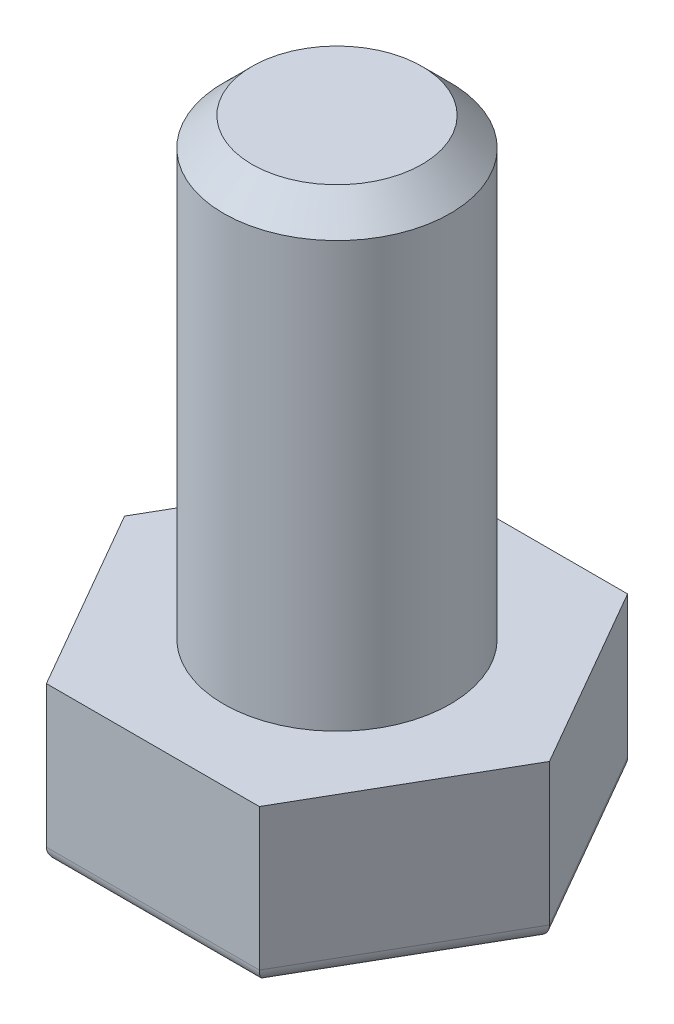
SolidWorks part; units mm, degrees
ref_plane "Plan de face" through (0, 0, 0) normal (0, 0, 1) x (1, 0, 0)
ref_plane "Plan de dessus" through (0, 0, 0) normal (0, 1, 0) x (1, 0, 0)
ref_plane "Plan de droite" through (0, 0, 0) normal (1, 0, 0) x (0, 0, -1)
sketch "Esquisse1" plane through (0, 0, 0) normal (0, 1, 0) x (1, 0, 0)
  line L0 (-7.5, 0) -> (7.5, 0) construction
  line L1 (0, -6.5) -> (0, 6.5) construction
  line L2 (-3.7583, 6.5) -> (3.7583, 6.5)
  line L3 (3.7583, 6.5) -> (7.5, 0)
  line L4 (-3.7583, 6.5) -> (-7.5, 0)
  line L5 (-3.7583, -6.5) -> (-7.5, 0)
  line L6 (3.7583, -6.5) -> (7.5, 0)
  line L7 (-3.7583, -6.5) -> (3.7583, -6.5)
  point P8 (0, 0)
  dimension "D1" = 13
  dimension "D2" = 13
  dimension "D3" = 15
extrude "Extrusion1" add sketch "Esquisse1" along normal blind 5.5
fillet "Congé1" radius 0.5 6 edges at (-5.6292, 0, 3.25) (-5.6292, 0, -3.25) (0, 0, -6.5) (5.6292, 0, -3.25) (5.6292, 0, 3.25) (0, 0, 6.5)
sketch "Esquisse2" plane through (0, 5.5, 0) normal (0, 1, 0) x (-1, 0, 0)
  circle A0 centre (0, 0) radius 4
  dimension "D1" = 8
extrude "Extrusion2" add sketch "Esquisse2" along normal blind 16
chamfer "Chanfrein1" distance 1 angle 45 1 edges at (0, 21.5, 4)
